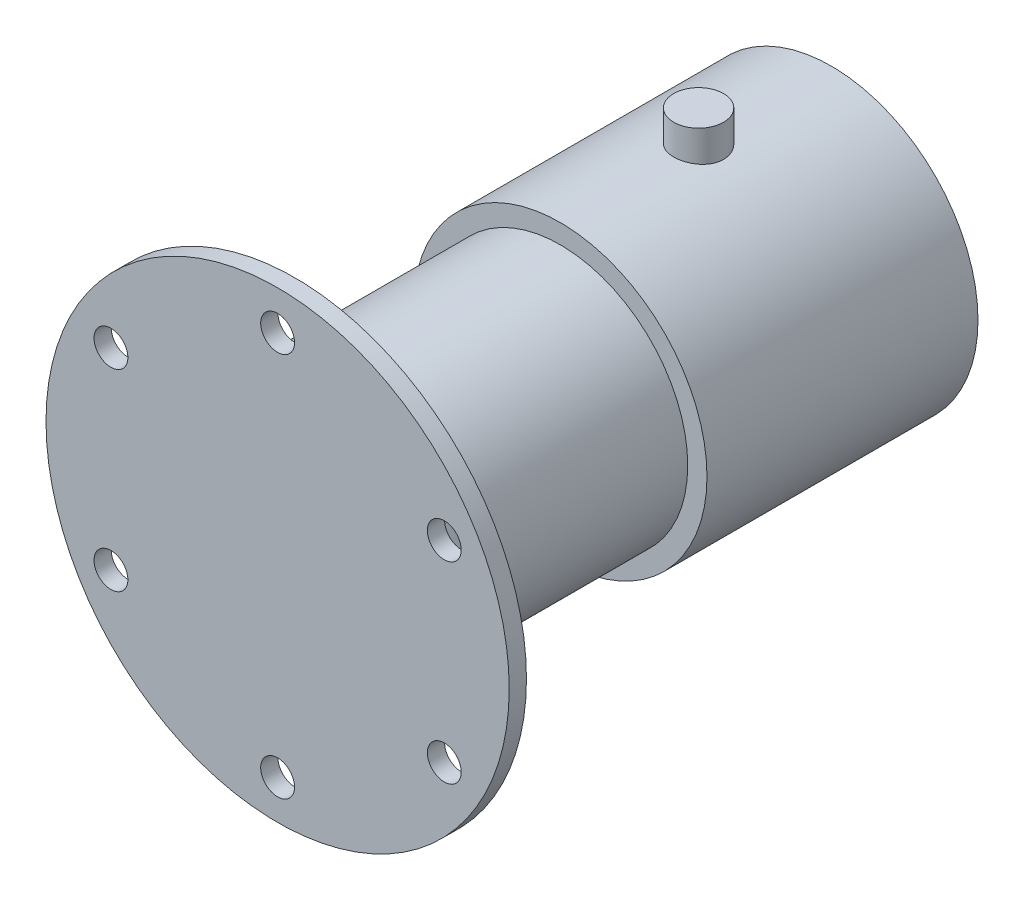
SolidWorks part; units mm, degrees
ref_plane "Front" through (0, 0, 0) normal (0, 0, 1) x (1, 0, 0)
ref_plane "Top" through (0, 0, 0) normal (0, 1, 0) x (1, 0, 0)
ref_plane "Right" through (0, 0, 0) normal (1, 0, 0) x (0, 0, -1)
mirrored part "1019241-FO-OCEAN DESIGN_Mirrored"
other "<1019241-FO-OCEAN DESIGN>-<Extrude6>"
